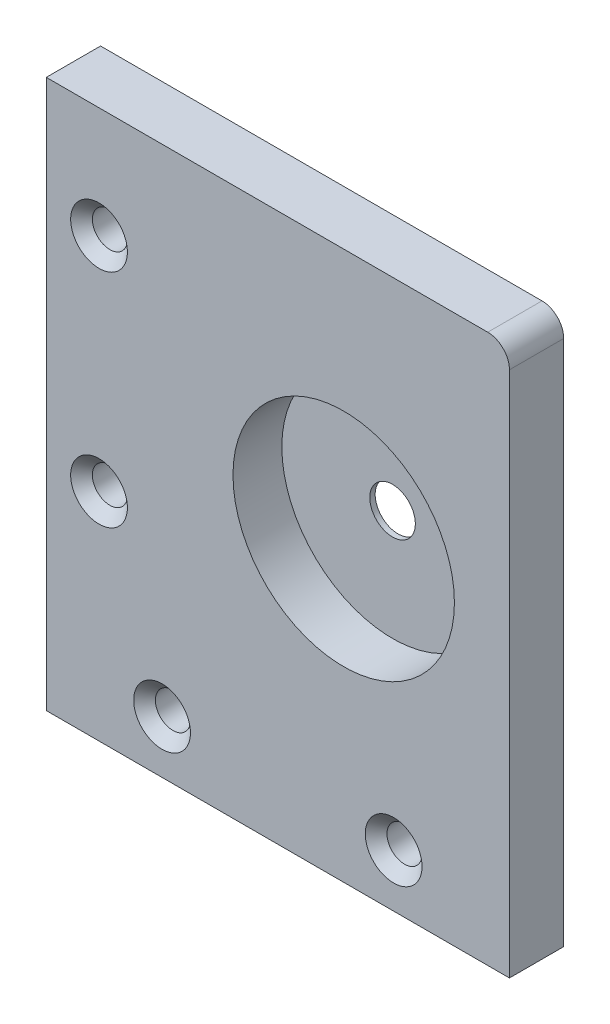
SolidWorks part; units mm, degrees
ref_plane "Front Plane" through (0, 0, 0) normal (0, 0, 1) x (1, 0, 0)
ref_plane "Top Plane" through (0, 0, 0) normal (0, 1, 0) x (1, 0, 0)
ref_plane "Right Plane" through (0, 0, 0) normal (1, 0, 0) x (0, 0, -1)
sketch "Sketch1" plane through (0, 0, 0) normal (0, 0, 1) x (1, 0, 0)
  line L6 (-810.8141, 612.9135) -> (-817.6657, 612.9135)
  line L7 (-810.8141, 612.9135) -> (-779.225, 612.9135)
  line L8 (-493.7649, 564.4955) -> (-493.7649, 1167.7963)
  line L9 (-493.7649, 1167.7963) -> (-817.6657, 1167.7963)
  line L10 (-817.6657, 1167.7963) -> (-817.6657, 564.4955)
  line L11 (-817.6657, 564.4955) -> (-493.7649, 564.4955)
  line L12 (-779.225, 612.9135) -> (-779.225, 571.3471)
  line L13 (-779.225, 571.3471) -> (-779.225, 564.4955)
  circle A2 centre (-798.6157, 583.5455) radius 2.667
extrude "Boss-Extrude1" add sketch "Sketch1" along normal blind 6.35 contours L13 L12 L7 L6 L10 L11 A2
sketch "Sketch2" plane through (0, 0, 6.35) normal (0, 0, 1) x (1, 0, 0)
  line L0 (-779.225, 564.4955) -> (-779.225, 555.0975)
  line L1 (-817.6657, 612.9135) -> (-827.0637, 612.9135)
  line L3 (-827.0637, 612.9135) -> (-779.225, 612.9135)
  line L4 (-779.225, 564.4955) -> (-779.225, 612.9135)
  line L5 (-779.225, 612.9135) -> (-817.6657, 612.9135)
  line L6 (-817.6657, 612.9135) -> (-817.6657, 564.4955)
  line L7 (-817.6657, 564.4955) -> (-779.225, 564.4955)
  line L8 (-779.225, 564.4955) -> (-779.225, 612.9135)
  line L9 (-779.225, 612.9135) -> (-817.6657, 612.9135)
  line L10 (-817.6657, 612.9135) -> (-817.6657, 564.4955)
  line L11 (-817.6657, 564.4955) -> (-779.225, 564.4955)
  line L12 (-827.0637, 612.9135) -> (-827.0637, 555.0975)
  line L13 (-827.0637, 555.0975) -> (-779.225, 555.0975)
  line L14 (-779.225, 612.9135) -> (-779.225, 555.0975)
  dimension "D2" = 9.398
  dimension "D1" = 0
extrude "Boss-Extrude2" add sketch "Sketch2" against normal up to vertex (996.0964 mm away) contours L12 L13 L0 L1 M15 M14
sketch "Sketch6" plane through (0, 0, 0) normal (0, 0, -1) x (-1, 0, 0)
  line L4 (779.225, 612.9135) -> (779.225, 555.0975)
  line L5 (779.225, 555.0975) -> (827.0637, 555.0975)
  line L6 (827.0637, 555.0975) -> (827.0637, 612.9135)
  line L7 (827.0637, 612.9135) -> (779.225, 612.9135)
  line L8 (779.225, 612.9135) -> (779.225, 555.0975)
  line L9 (779.225, 555.0975) -> (827.0637, 555.0975)
  line L10 (827.0637, 555.0975) -> (827.0637, 612.9135)
  line L11 (827.0637, 612.9135) -> (779.225, 612.9135)
  line L12 (804.9657, 562.1587) -> (817.4117, 562.1587)
  line L14 (819.1897, 562.1587) -> (820.0025, 562.1587)
  line L15 (820.0025, 562.1587) -> (820.0025, 612.9135)
  line L20 (817.4117, 562.1587) -> (819.1897, 562.1587)
  line L21 (804.9657, 562.1587) -> (779.225, 562.1587)
  dimension "D1" = 0
extrude "Boss-Extrude4" add sketch "Sketch6" along normal up to surface (78.0796 mm away) contours L12 L21 L8 L15 L14 L20 M11 M12 M13
sketch "Sketch7" plane through (0, 0, -78.0796) normal (0, 0, -1) x (-1, 0, 0)
  line L6 (805.2197, 576.9415) -> (805.2197, 612.9135)
  line L7 (779.225, 576.9415) -> (804.6609, 576.9415)
  line L8 (820.0025, 612.9135) -> (827.0637, 612.9135)
  line L9 (827.0637, 612.9135) -> (827.0637, 555.0975)
  line L10 (827.0637, 555.0975) -> (779.225, 555.0975)
  line L11 (779.225, 555.0975) -> (779.225, 562.1587)
  line L12 (779.225, 562.1587) -> (779.225, 576.9415)
  line L13 (820.0025, 612.9135) -> (805.2197, 612.9135)
  line L14 (804.6609, 576.9415) -> (805.2197, 576.9415)
  circle A2 centre (791.9609, 571.3471) radius 2.3812
  circle A3 centre (810.8141, 600.2587) radius 2.3812
sketch "Sketch8" plane through (0, 0, -78.0796) normal (0, 0, -1) x (-1, 0, 0)
  line L9 (805.2197, 612.9135) -> (805.2197, 576.9415)
  line L10 (820.0025, 612.9135) -> (805.2197, 612.9135)
  line L11 (827.0637, 612.9135) -> (820.0025, 612.9135)
  line L12 (827.0637, 555.0975) -> (827.0637, 612.9135)
  line L13 (779.225, 555.0975) -> (827.0637, 555.0975)
  line L14 (779.225, 562.1587) -> (779.225, 555.0975)
  line L15 (779.225, 576.9415) -> (779.225, 562.1587)
  line L16 (804.6609, 576.9415) -> (779.225, 576.9415)
  line L17 (805.2197, 576.9415) -> (804.6609, 576.9415)
  line L18 (805.2197, 612.9135) -> (805.2197, 576.9415)
  line L19 (820.0025, 612.9135) -> (805.2197, 612.9135)
  line L20 (827.0637, 612.9135) -> (820.0025, 612.9135)
  line L21 (827.0637, 555.0975) -> (827.0637, 612.9135)
  line L22 (779.225, 555.0975) -> (827.0637, 555.0975)
  line L23 (779.225, 562.1587) -> (779.225, 555.0975)
  line L24 (779.225, 576.9415) -> (779.225, 562.1587)
  line L25 (804.6609, 576.9415) -> (779.225, 576.9415)
  line L26 (805.2197, 576.9415) -> (804.6609, 576.9415)
  circle A1 centre (810.8141, 600.2587) radius 2.3813
  circle A2 centre (810.8141, 600.2587) radius 2.3812
  circle A3 centre (791.9609, 571.3471) radius 2.3813
  circle A4 centre (791.9609, 571.3471) radius 2.3812
  dimension "D1" = 0
  dimension "D2" = 0
  dimension "D3" = 0
extrude "Boss-Extrude6" add sketch "Sketch8" along normal blind 2.54
other "Cavity1"
other "5 SIDED ENCLOSURE 3 INCH.stp<1>@Assem11"
sketch "Sketch9" plane through (0, 612.9135, 0) normal (0, 1, 0) x (1, 0, 0)
  line L0 (-820.7645, 76.454) -> (-820.8153, 73.0504)
  line L1 (-820.8153, 3.1496) -> (-820.8153, 0)
  line L2 (-820.8153, 0) -> (-820.0025, 0)
  line L3 (-820.0025, 76.454) -> (-820.0025, 78.0796)
  line L4 (-820.0025, 78.0796) -> (-820.0025, 0)
  line L5 (-820.8153, 0) -> (-821.0693, 0)
  line L6 (-821.0693, 0) -> (-821.0693, 78.0796)
  line L7 (-821.0693, 78.0796) -> (-820.7645, 78.0796)
  line L12 (-820.7645, 76.454) -> (-820.7645, 78.0796)
  line L13 (-820.7645, 78.0796) -> (-805.2197, 78.0796)
  line L14 (-805.2197, 78.0796) -> (-805.2197, 80.6196)
  line L15 (-805.2197, 80.6196) -> (-827.0637, 80.6196)
  line L16 (-827.0637, 80.6196) -> (-827.0637, -6.35)
  line L17 (-827.0637, -6.35) -> (-779.225, -6.35)
  line L18 (-779.225, -6.35) -> (-779.225, 0)
  line L19 (-779.225, 0) -> (-820.0025, 0)
  line L20 (-820.0025, 0) -> (-820.0025, 1.0379)
  line L21 (-820.8153, 3.1496) -> (-820.8153, 73.0504)
  line L22 (-820.0025, 75.1621) -> (-820.0025, 76.454)
  line L23 (-820.0025, 76.454) -> (-820.7645, 76.454)
  line L24 (-820.7645, 76.454) -> (-820.7645, 78.0796)
  line L25 (-820.7645, 78.0796) -> (-805.2197, 78.0796)
  line L26 (-805.2197, 78.0796) -> (-805.2197, 80.6196)
  line L27 (-805.2197, 80.6196) -> (-827.0637, 80.6196)
  line L28 (-827.0637, 80.6196) -> (-827.0637, -6.35)
  line L29 (-827.0637, -6.35) -> (-779.225, -6.35)
  line L30 (-779.225, -6.35) -> (-779.225, 0)
  line L31 (-779.225, 0) -> (-820.0025, 0)
  line L32 (-820.0025, 0) -> (-820.0025, 1.0379)
  line L33 (-820.8153, 3.1496) -> (-820.8153, 73.0504)
  line L34 (-820.0025, 75.1621) -> (-820.0025, 76.454)
  line L35 (-820.0025, 76.454) -> (-820.7645, 76.454)
  arc A2 (-820.8153, 3.1496) -> (-820.0025, 1.0379) centre (-817.6657, 3.1496) ccw
  arc A3 (-820.0025, 75.1621) -> (-820.8153, 73.0504) centre (-817.6657, 73.0504) ccw
  arc A4 (-820.8153, 3.1496) -> (-820.0025, 1.0379) centre (-817.6657, 3.1496) ccw
  arc A5 (-820.0025, 75.1621) -> (-820.8153, 73.0504) centre (-817.6657, 73.0504) ccw
  dimension "D2" = 0.254
  dimension "D1" = 0
extrude "Cut-Extrude3" cut sketch "Sketch9" against normal up to surface (50.7548 mm away) contours L0 M28 M26 M27 | L7 L6 L5 L1 L0 M25 M26 M15 | L1 L2 M23 M24
sketch "Sketch10" plane through (-779.225, 0, 0) normal (1, 0, 0) x (0, 0, -1)
  line L0 (78.0796, 561.3459) -> (78.0796, 561.0919)
  line L1 (78.0796, 561.0919) -> (0, 561.0919)
  line L2 (0, 561.0919) -> (0, 562.1587)
  line L4 (24.4475, 562.1587) -> (24.4475, 561.3459) construction
  line L5 (24.4475, 562.1587) -> (24.4475, 561.3459)
  line L6 (0, 562.4127) -> (0, 562.1587)
  line L7 (0, 562.4127) -> (78.0796, 562.4127)
  line L8 (76.1963, 562.4127) -> (76.1963, 562.1587)
  line L9 (78.0796, 562.4127) -> (76.1963, 562.4127)
  line L10 (78.0796, 562.4127) -> (78.0796, 565.7277)
  line L11 (78.0796, 565.7277) -> (76.1963, 565.7277)
  line L12 (78.0796, 576.9415) -> (78.0796, 561.3459)
  line L13 (78.0796, 561.3459) -> (76.454, 561.3459)
  line L14 (76.454, 561.3459) -> (76.454, 562.1587)
  line L15 (76.454, 562.1587) -> (75.1621, 562.1587)
  line L16 (73.0504, 561.3459) -> (3.1496, 561.3459)
  line L17 (1.0379, 562.1587) -> (0, 562.1587)
  line L18 (0, 562.1587) -> (0, 612.9135)
  line L19 (0, 612.9135) -> (-6.35, 612.9135)
  line L20 (-6.35, 612.9135) -> (-6.35, 555.0975)
  line L21 (-6.35, 555.0975) -> (80.6196, 555.0975)
  line L22 (80.6196, 555.0975) -> (80.6196, 576.9415)
  line L23 (80.6196, 576.9415) -> (78.0796, 576.9415)
  line L24 (78.0796, 576.9415) -> (78.0796, 561.3459)
  line L25 (78.0796, 561.3459) -> (76.454, 561.3459)
  line L26 (76.454, 561.3459) -> (76.454, 562.1587)
  line L27 (76.454, 562.1587) -> (75.1621, 562.1587)
  line L28 (73.0504, 561.3459) -> (3.1496, 561.3459)
  line L29 (1.0379, 562.1587) -> (0, 562.1587)
  line L30 (0, 562.1587) -> (0, 612.9135)
  line L31 (0, 612.9135) -> (-6.35, 612.9135)
  line L32 (-6.35, 612.9135) -> (-6.35, 555.0975)
  line L33 (-6.35, 555.0975) -> (80.6196, 555.0975)
  line L34 (80.6196, 555.0975) -> (80.6196, 576.9415)
  line L35 (80.6196, 576.9415) -> (78.0796, 576.9415)
  line L36 (76.1963, 562.4127) -> (76.1963, 565.7277)
  line L37 (0, 561.0919) -> (3.4229, 561.0919)
  line L38 (0, 561.0919) -> (0, 564.0863)
  line L39 (0, 564.0863) -> (3.4229, 564.0863)
  line L40 (3.4229, 561.0919) -> (3.4229, 564.0863)
  arc A2 (73.0504, 561.3459) -> (75.1621, 562.1587) centre (73.0504, 564.4955) ccw
  arc A3 (1.0379, 562.1587) -> (3.1496, 561.3459) centre (3.1496, 564.4955) ccw
  arc A4 (73.0504, 561.3459) -> (75.1621, 562.1587) centre (73.0504, 564.4955) ccw
  arc A5 (1.0379, 562.1587) -> (3.1496, 561.3459) centre (3.1496, 564.4955) ccw
  dimension "D2" = 0.254
  dimension "D3" = 0.254
  dimension "D1" = 0
extrude "Cut-Extrude5" cut sketch "Sketch10" against normal up to surface (41.8444 mm away)
sketch "Sketch12" plane through (0, 0, -80.6196) normal (0, 0, -1) x (-1, 0, 0)
  line L6 (827.0637, 612.9135) -> (805.2197, 612.9135)
  line L7 (805.2197, 612.9135) -> (805.2197, 576.9415)
  line L8 (805.2197, 576.9415) -> (779.225, 576.9415)
  line L9 (779.225, 576.9415) -> (779.225, 555.0975)
  line L10 (779.225, 555.0975) -> (827.0637, 555.0975)
  line L11 (827.0637, 555.0975) -> (827.0637, 612.9135)
  line L12 (827.0637, 612.9135) -> (805.2197, 612.9135)
  line L13 (805.2197, 612.9135) -> (805.2197, 576.9415)
  line L14 (805.2197, 576.9415) -> (779.225, 576.9415)
  line L15 (779.225, 576.9415) -> (779.225, 555.0975)
  line L16 (779.225, 555.0975) -> (827.0637, 555.0975)
  line L17 (827.0637, 555.0975) -> (827.0637, 612.9135)
  circle A1 centre (791.9609, 571.3471) radius 2.3813
  circle A2 centre (791.9609, 571.3471) radius 2.3812
  circle A3 centre (810.8141, 600.2587) radius 2.3813
  circle A4 centre (810.8141, 600.2587) radius 2.3812
  dimension "D1" = 0
  dimension "D2" = 0
  dimension "D3" = 0
extrude "Boss-Extrude7" add sketch "Sketch12" along normal blind 3.81
sketch "Sketch13" plane through (0, 0, -84.4296) normal (0, 0, -1) x (-1, 0, 0)
  line L0 (797.5235, 571.3471) -> (797.5235, 576.9415)
  line L1 (805.2197, 576.9415) -> (779.225, 576.9415) construction
  line L2 (786.3983, 571.3471) -> (786.3983, 576.9415)
  line L3 (810.8141, 594.6961) -> (805.2197, 594.6961)
  line L4 (805.2197, 612.9135) -> (805.2197, 576.9415) construction
  line L5 (810.8141, 605.8213) -> (805.2197, 605.8213)
  line L12 (827.0637, 612.9135) -> (805.2197, 612.9135)
  line L13 (805.2197, 612.9135) -> (805.2197, 576.9415)
  line L14 (805.2197, 576.9415) -> (779.225, 576.9415)
  line L15 (779.225, 576.9415) -> (779.225, 555.0975)
  line L16 (779.225, 555.0975) -> (827.0637, 555.0975)
  line L17 (827.0637, 555.0975) -> (827.0637, 612.9135)
  line L18 (827.0637, 612.9135) -> (805.2197, 612.9135)
  line L19 (805.2197, 612.9135) -> (805.2197, 576.9415)
  line L20 (805.2197, 576.9415) -> (779.225, 576.9415)
  line L21 (779.225, 576.9415) -> (779.225, 555.0975)
  line L22 (779.225, 555.0975) -> (827.0637, 555.0975)
  line L23 (827.0637, 555.0975) -> (827.0637, 612.9135)
  circle A2 centre (810.8141, 600.2587) radius 3.0226
  circle A3 centre (791.9609, 571.3471) radius 3.0226
  circle A4 centre (791.9609, 571.3471) radius 5.5626
  circle A5 centre (810.8141, 600.2587) radius 5.5626
  dimension "D1" = 2.54
  dimension "D2" = 0
extrude "Cut-Extrude7" cut sketch "Sketch13" against normal blind 5.715 contours M16 | A5 A2 | A5 L5 L3 M7 | M3 | A3 M3 | A4 A3 | A4 L0 L2 M9
fillet "Fillet3" radius 1.27 4 edges at (-805.2197, 605.8213, -81.5721) (-805.2197, 594.6961, -81.5721) (-797.5235, 576.9415, -81.5721) (-786.3983, 576.9415, -81.5721)
sketch "Sketch14" plane through (0, 0, 6.35) normal (0, 0, 1) x (1, 0, 0)
  line L4 (-779.225, 612.9135) -> (-827.0637, 612.9135)
  line L5 (-827.0637, 612.9135) -> (-827.0637, 555.0975)
  line L6 (-827.0637, 555.0975) -> (-779.225, 555.0975)
  line L7 (-779.225, 555.0975) -> (-779.225, 612.9135)
  line L8 (-779.225, 612.9135) -> (-827.0637, 612.9135)
  line L9 (-827.0637, 612.9135) -> (-827.0637, 555.0975)
  line L10 (-827.0637, 555.0975) -> (-779.225, 555.0975)
  line L11 (-779.225, 555.0975) -> (-779.225, 612.9135)
  circle A1 centre (-798.6157, 583.5455) radius 12.7
  circle A2 centre (-798.6157, 583.5455) radius 12.954
  dimension "D1" = 0
  dimension "D2" = 0.254
extrude "Cut-Extrude8" cut sketch "Sketch14" against normal blind 5.715 contours A2 A1 | A1 M9 | M9
fillet "Fillet4" radius 2.54 3 edges at (-779.225, 576.9415, -81.2546) (-805.2197, 612.9135, -81.2546) (-779.225, 612.9135, 3.175)
sketch "Sketch15" plane through (0, 0, -84.4296) normal (0, 0, -1) x (-1, 0, 0)
  line L4 (821.0693, 612.9135) -> (781.765, 612.9135)
  line L5 (779.225, 610.3735) -> (779.225, 561.0919)
  line L6 (779.225, 561.0919) -> (821.0693, 561.0919)
  line L7 (821.0693, 561.0919) -> (821.0693, 612.9135)
  line L8 (821.0693, 612.9135) -> (781.765, 612.9135)
  line L9 (779.225, 610.3735) -> (779.225, 561.0919)
  line L10 (779.225, 561.0919) -> (821.0693, 561.0919)
  line L11 (821.0693, 561.0919) -> (821.0693, 612.9135)
  line L20 (785.1283, 576.9415) -> (781.765, 576.9415)
  line L21 (779.225, 574.4015) -> (779.225, 555.0975)
  line L22 (779.225, 555.0975) -> (827.0637, 555.0975)
  line L23 (827.0637, 555.0975) -> (827.0637, 612.9135)
  line L24 (827.0637, 612.9135) -> (807.7597, 612.9135)
  line L25 (805.2197, 610.3735) -> (805.2197, 607.0913)
  line L26 (806.4897, 605.8213) -> (810.8141, 605.8213)
  line L27 (810.8141, 594.6961) -> (806.4897, 594.6961)
  line L28 (805.2197, 593.4261) -> (805.2197, 576.9415)
  line L29 (805.2197, 576.9415) -> (798.7935, 576.9415)
  line L30 (797.5235, 575.6715) -> (797.5235, 571.3471)
  line L31 (786.3983, 571.3471) -> (786.3983, 575.6715)
  line L32 (785.1283, 576.9415) -> (781.765, 576.9415)
  line L33 (779.225, 574.4015) -> (779.225, 555.0975)
  line L34 (779.225, 555.0975) -> (827.0637, 555.0975)
  line L35 (827.0637, 555.0975) -> (827.0637, 612.9135)
  line L36 (827.0637, 612.9135) -> (807.7597, 612.9135)
  line L37 (805.2197, 610.3735) -> (805.2197, 607.0913)
  line L38 (806.4897, 605.8213) -> (810.8141, 605.8213)
  line L39 (810.8141, 594.6961) -> (806.4897, 594.6961)
  line L40 (805.2197, 593.4261) -> (805.2197, 576.9415)
  line L41 (805.2197, 576.9415) -> (798.7935, 576.9415)
  line L42 (797.5235, 575.6715) -> (797.5235, 571.3471)
  line L43 (786.3983, 571.3471) -> (786.3983, 575.6715)
  arc A1 (781.765, 612.9135) -> (779.225, 610.3735) centre (781.765, 610.3735) ccw
  arc A2 (781.765, 612.9135) -> (779.225, 610.3735) centre (781.765, 610.3735) ccw
  arc A10 (781.765, 576.9415) -> (779.225, 574.4015) centre (781.765, 574.4015) ccw
  arc A11 (807.7597, 612.9135) -> (805.2197, 610.3735) centre (807.7597, 610.3735) ccw
  arc A12 (805.2197, 607.0913) -> (806.4897, 605.8213) centre (806.4897, 607.0913) ccw
  arc A13 (810.8141, 594.6961) -> (810.8141, 605.8213) centre (810.8141, 600.2587) ccw
  arc A14 (806.4897, 594.6961) -> (805.2197, 593.4261) centre (806.4897, 593.4261) ccw
  arc A15 (798.7935, 576.9415) -> (797.5235, 575.6715) centre (798.7935, 575.6715) ccw
  arc A16 (786.3983, 571.3471) -> (797.5235, 571.3471) centre (791.9609, 571.3471) ccw
  arc A17 (786.3983, 575.6715) -> (785.1283, 576.9415) centre (785.1283, 575.6715) ccw
  arc A18 (781.765, 576.9415) -> (779.225, 574.4015) centre (781.765, 574.4015) ccw
  arc A19 (807.7597, 612.9135) -> (805.2197, 610.3735) centre (807.7597, 610.3735) ccw
  arc A20 (805.2197, 607.0913) -> (806.4897, 605.8213) centre (806.4897, 607.0913) ccw
  arc A21 (810.8141, 594.6961) -> (810.8141, 605.8213) centre (810.8141, 600.2587) ccw
  arc A22 (806.4897, 594.6961) -> (805.2197, 593.4261) centre (806.4897, 593.4261) ccw
  arc A23 (798.7935, 576.9415) -> (797.5235, 575.6715) centre (798.7935, 575.6715) ccw
  arc A24 (786.3983, 571.3471) -> (797.5235, 571.3471) centre (791.9609, 571.3471) ccw
  arc A25 (786.3983, 575.6715) -> (785.1283, 576.9415) centre (785.1283, 575.6715) ccw
  dimension "D1" = 0
  dimension "D2" = 0
extrude "Cut-Extrude9" cut sketch "Sketch15" against normal up to surface (84.4296 mm away) contours L11 L10 M28 M29 M30 M31 | L10 L11 M31 M32 M33 M34 M35 M36 M37 M38 M39 M40 M41 M42 M43 M44 M45 M26 M27 M28 | L8 A2 L9 M27 M26 M45 M44 M43 M42 M41 M40 M39 M38 M37 M36 M35 M34 M33 M32
sketch "Sketch17" plane through (0, 0, 6.35) normal (0, 0, 1) x (1, 0, 0)
  line L4 (-779.225, 555.0975) -> (-779.225, 610.3735)
  line L5 (-781.765, 612.9135) -> (-827.0637, 612.9135)
  line L6 (-827.0637, 612.9135) -> (-827.0637, 555.0975)
  line L7 (-827.0637, 555.0975) -> (-779.225, 555.0975)
  line L8 (-779.225, 555.0975) -> (-779.225, 610.3735)
  line L9 (-781.765, 612.9135) -> (-827.0637, 612.9135)
  line L10 (-827.0637, 612.9135) -> (-827.0637, 555.0975)
  line L11 (-827.0637, 555.0975) -> (-779.225, 555.0975)
  line L16 (-833.4137, 612.9135) -> (-833.4137, 555.0975)
  line L17 (-833.4137, 555.0975) -> (-827.0637, 555.0975)
  line L18 (-827.0637, 555.0975) -> (-827.0637, 612.9135)
  line L19 (-827.0637, 612.9135) -> (-833.4137, 612.9135)
  line L20 (-779.225, 555.0975) -> (-833.4137, 555.0975)
  line L21 (-833.4137, 555.0975) -> (-833.4137, 548.7475)
  line L22 (-833.4137, 548.7475) -> (-779.225, 548.7475)
  line L23 (-779.225, 548.7475) -> (-779.225, 555.0975)
  arc A1 (-779.225, 610.3735) -> (-781.765, 612.9135) centre (-781.765, 610.3735) ccw
  arc A2 (-779.225, 610.3735) -> (-781.765, 612.9135) centre (-781.765, 610.3735) ccw
  dimension "D1" = 0
extrude "Boss-Extrude8" add sketch "Sketch17" against normal up to surface (6.35 mm away) contours L22 L23 L17 L21 M11 | L19 L16 L17 M10
sketch "Sketch18" plane through (0, 0, 6.35) normal (0, 0, 1) x (1, 0, 0)
  circle A2 centre (-792.7722, 554.9197) radius 2.05
  circle A4 centre (-827.2415, 599.9581) radius 2.05
  circle A6 centre (-827.2415, 574.0473) radius 2.05
  circle A8 centre (-819.8666, 554.9197) radius 2.05
  dimension "D1" = 4.1
extrude "Cut-Extrude10" cut sketch "Sketch18" against normal through all
sketch "Sketch19" plane through (0, 548.7475, 0) normal (0, -1, 0) x (1, 0, 0)
  line L10 (-833.4137, -58.5597) -> (-821.0693, -58.5597)
  line L15 (-833.4137, -39.0398) -> (-827.2415, -39.0398)
  line L19 (-833.4137, -78.0796) -> (-821.0693, -78.0796)
  line L20 (-779.225, -78.0796) -> (-779.225, -65.993)
  line L21 (-781.765, -63.453) -> (-789.8079, -63.453)
  line L22 (-792.3479, -60.913) -> (-792.3479, -28.549)
  line L23 (-794.8879, -26.009) -> (-814.785, -26.009)
  line L24 (-817.325, -23.469) -> (-817.325, -8.89)
  line L25 (-814.785, -6.35) -> (-781.765, -6.35)
  line L26 (-779.225, -3.81) -> (-779.225, 0)
  line L27 (-779.225, 0) -> (-833.4137, 0)
  line L28 (-833.4137, -39.0398) -> (-833.4137, -78.0796)
  line L29 (-833.4137, -78.0796) -> (-779.225, -78.0796)
  line L30 (-833.4137, -39.0398) -> (-833.4137, -78.0796)
  line L31 (-821.0693, 0) -> (-833.4137, 0)
  line L32 (-821.0693, -78.0796) -> (-821.0693, 0)
  circle A6 centre (-827.2415, -58.5597) radius 2.05
  circle A7 centre (-827.2415, -19.5199) radius 2.05
  arc A12 (-779.225, -65.993) -> (-781.765, -63.453) centre (-781.765, -65.993) ccw
  arc A13 (-792.3479, -60.913) -> (-789.8079, -63.453) centre (-789.8079, -60.913) ccw
  arc A14 (-792.3479, -28.549) -> (-794.8879, -26.009) centre (-794.8879, -28.549) ccw
  arc A15 (-817.325, -23.469) -> (-814.785, -26.009) centre (-814.785, -23.469) ccw
  arc A16 (-814.785, -6.35) -> (-817.325, -8.89) centre (-814.785, -8.89) ccw
  arc A17 (-781.765, -6.35) -> (-779.225, -3.81) centre (-781.765, -3.81) ccw
  point P12 (-833.4137, -58.5597)
  dimension "D1" = 4.1
chamfer "Chamfer1" distance 1.27 angle 45 4 edges at (-825.1915, 599.9581, 6.35) (-825.1915, 574.0473, 6.35) (-790.7222, 554.9197, 6.35) (-817.8166, 554.9197, 6.35)
